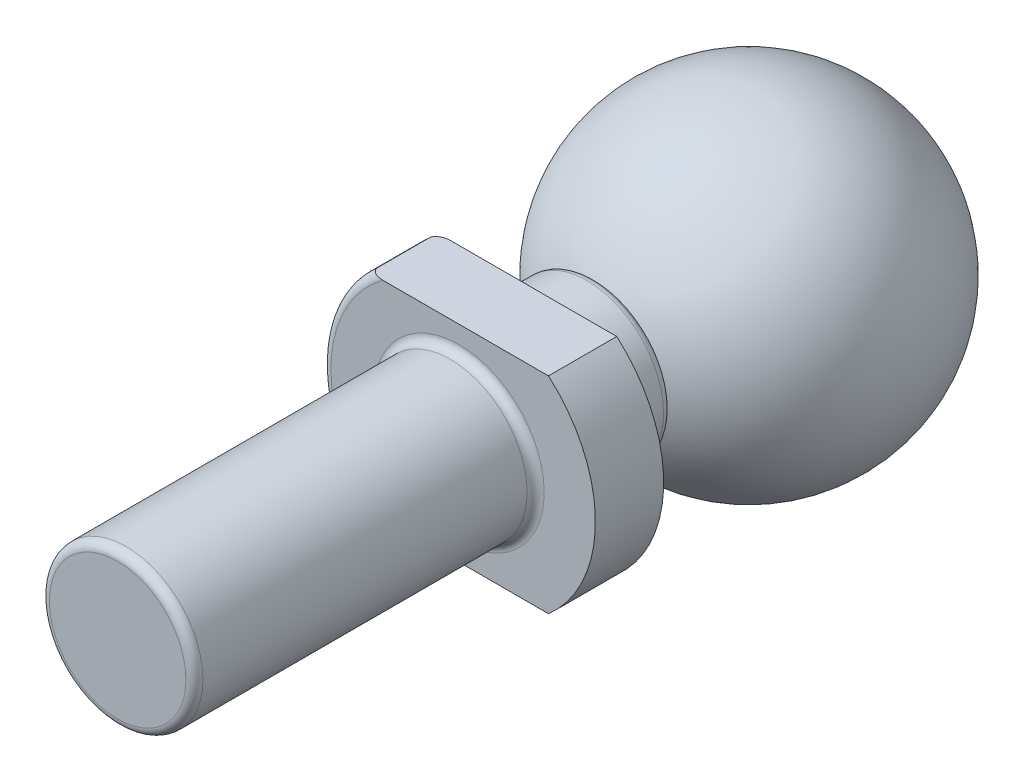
SolidWorks part; units mm, degrees
ref_plane "Plan de face" through (0, 0, 0) normal (0, 0, 1) x (1, 0, 0)
ref_plane "Plan de dessus" through (0, 0, 0) normal (0, 1, 0) x (1, 0, 0)
ref_plane "Plan de droite" through (0, 0, 0) normal (1, 0, 0) x (0, 0, -1)
sketch "Esquisse1" plane through (0, 0, 0) normal (0, 0, 1) x (1, 0, 0)
  line L0 (0, 0) -> (0, 9.5)
  line L1 (0, -55) -> (0, 55) construction
  arc A0 (0, 9.5) -> (0, 0) centre (0, 4.75) cw
  dimension "D1" = 9.5
revolve "Révolution1" add sketch "Esquisse1" angle 360 about L0
ref_plane "Plan1" through (0, 0, 3) normal (0, 0, 1) x (1, 0, 0)
sketch "Esquisse2" plane through (0, 0, 3) normal (0, 0, 1) x (1, 0, 0)
  circle A0 centre (0, 4.75) radius 1.75
  circle A1 centre (0, 4.75) radius 4.75 construction
  dimension "D1" = 3.5
extrude "Enlèv. mat.-Extru.1" cut sketch "Esquisse2" along normal through all
sketch "Esquisse3" plane through (0, 0, 3) normal (0, 0, 1) x (1, 0, 0)
  circle A0 centre (0, 4.75) radius 1.5
  circle A1 centre (0, 4.75) radius 1.75 construction
  dimension "D1" = 3
extrude "Extrusion1" add sketch "Esquisse3" along normal blind 1.5
sketch "Esquisse4" plane through (0, 0, 4.5) normal (0, 0, 1) x (1, 0, 0)
  circle A0 centre (0, 4.75) radius 2.25
  circle A1 centre (0, 4.75) radius 1.5 construction
  dimension "D1" = 4.5
extrude "Extrusion2" add sketch "Esquisse4" along normal blind 2
sketch "Esquisse5" plane through (0, 0, 6.5) normal (0, 0, 1) x (1, 0, 0)
  circle A0 centre (0, 4.75) radius 4
  circle A1 centre (0, 4.75) radius 2.25 construction
  dimension "D1" = 8
extrude "Extrusion3" add sketch "Esquisse5" along normal blind 2
sketch "Esquisse6" plane through (0, 0, 8.5) normal (0, 0, 1) x (1, 0, 0)
  circle A0 centre (0, 4.75) radius 2.25
  circle A1 centre (0, 4.75) radius 4 construction
  dimension "D1" = 4.5
extrude "Extrusion4" add sketch "Esquisse6" along normal blind 10
sketch "Esquisse7" plane through (0, 0, 8.5) normal (0, 0, 1) x (1, 0, 0)
  line L0 (-2.625, 7.7682) -> (2.625, 7.7682)
  line L1 (2.625, 1.7318) -> (-2.625, 1.7318)
  circle A0 centre (0, 4.75) radius 4 construction
  arc A1 (2.625, 7.7682) -> (-2.625, 7.7682) centre (0, 4.75) ccw
  arc A2 (2.625, 1.7318) -> (-2.625, 1.7318) centre (0, 4.75) cw
  dimension "D1" = 5.25
extrude "Enlèv. mat.-Extru.2" cut sketch "Esquisse7" against normal up to next
fillet "Congé2" radius 0.25 6 edges at (2.25, 4.75, 4.5) (2.25, 4.75, 6.5) (2.25, 4.75, 8.5) (2.25, 4.75, 18.5) (-4, 4.75, 8.5) (-4, 4.75, 6.5)
